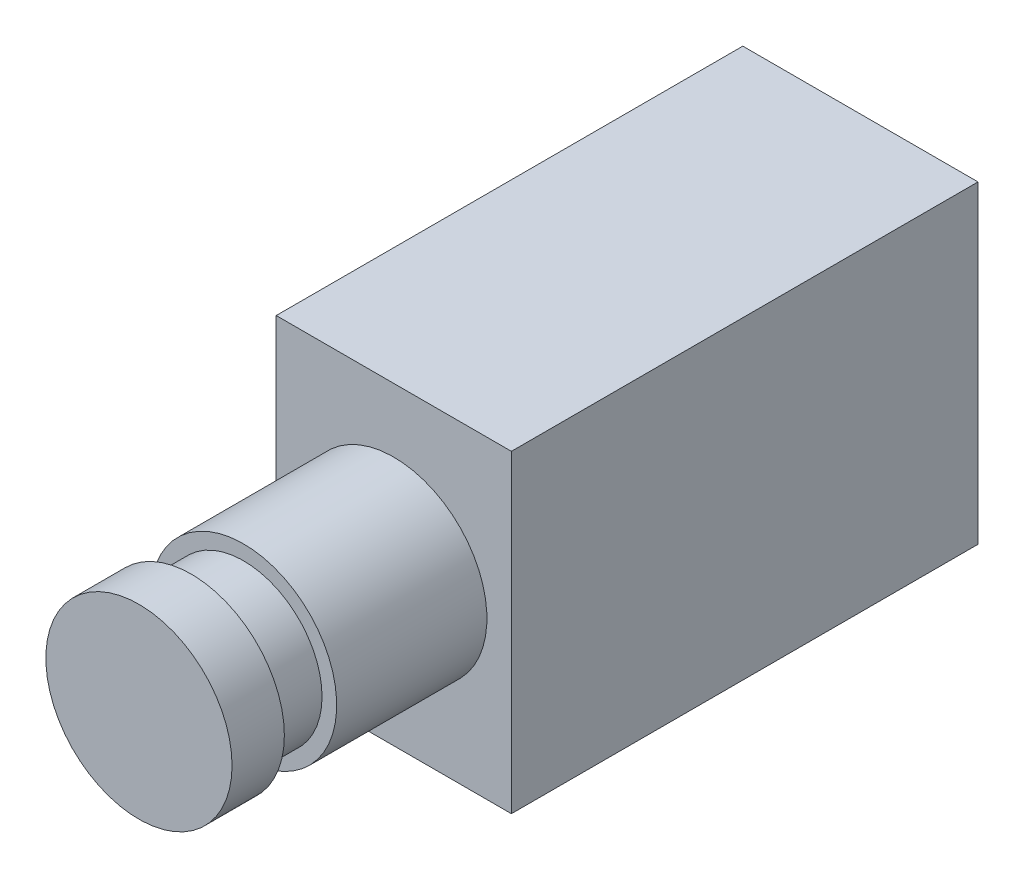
SolidWorks part; units mm, degrees
ref_plane "Front Plane" through (0, 0, 0) normal (0, 0, 1) x (1, 0, 0)
ref_plane "Top Plane" through (0, 0, 0) normal (0, 1, 0) x (1, 0, 0)
ref_plane "Right Plane" through (0, 0, 0) normal (1, 0, 0) x (0, 0, -1)
sketch "Sketch1" plane through (0, 0, 0) normal (0, 0, 1) x (1, 0, 0)
  line L1 (-7.1374, -9.525) -> (7.1374, -9.525)
  line L2 (-7.1374, -9.525) -> (-7.1374, 9.525)
  line L3 (-7.1374, 9.525) -> (7.1374, 9.525)
  line L4 (7.1374, -9.525) -> (7.1374, 9.525)
  line L5 (-7.1374, -9.525) -> (7.1374, 9.525) construction
  line L6 (-7.1374, 9.525) -> (7.1374, -9.525) construction
  point P0 (0, 0)
extrude "Boss-Extrude1" add sketch "Sketch1" along normal blind 28.321
sketch "Sketch2" plane through (0, 0, 28.321) normal (0, 0, 1) x (1, 0, 0)
  circle A0 centre (0, 0) radius 5.6515
extrude "Boss-Extrude2" add sketch "Sketch2" along normal blind 9.1186
sketch "Sketch3" plane through (0, 0, 37.4396) normal (0, 0, 1) x (1, 0, 0)
  circle A0 centre (0, 0) radius 4.7625
extrude "Boss-Extrude3" add sketch "Sketch3" along normal blind 3.175
sketch "Sketch4" plane through (0, 0, 40.6146) normal (0, 0, 1) x (1, 0, 0)
  circle A0 centre (0, 0) radius 5.6515
extrude "Boss-Extrude4" add sketch "Sketch4" along normal blind 3.175
